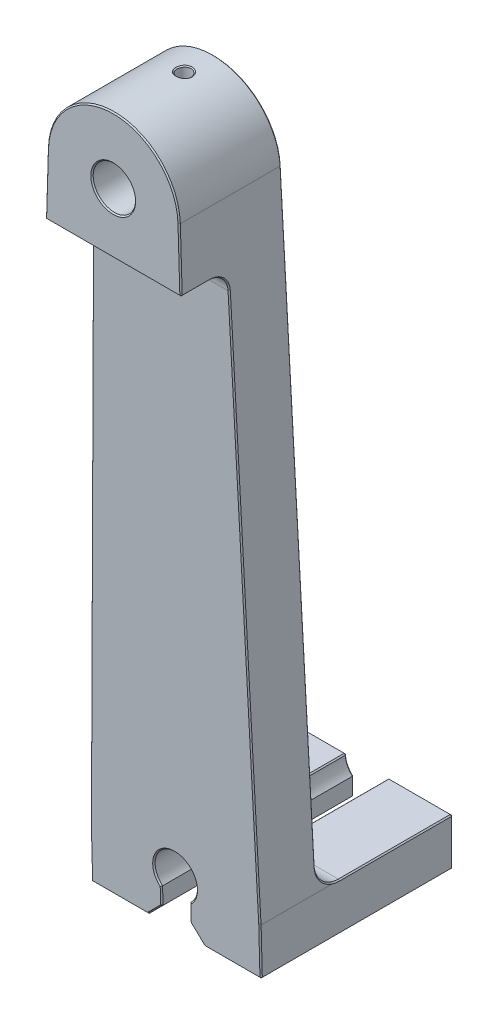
SolidWorks part; units mm, degrees
ref_plane "Спереди" through (0, 0, 0) normal (0, 0, 1) x (1, 0, 0)
ref_plane "Сверху" through (0, 0, 0) normal (0, 1, 0) x (1, 0, 0)
ref_plane "Справа" through (0, 0, 0) normal (1, 0, 0) x (0, 0, -1)
sketch "Эскиз1" plane through (0, 0, 0) normal (0, 0, 1) x (1, 0, 0)
  line L0 (0, 0) -> (0, -133) construction
  line L1 (-13.9937, 0.4202) -> (-18, -133)
  line L2 (-18, -133) -> (-18, -143)
  line L3 (-18, -143) -> (-6, -143)
  line L4 (-6, -143) -> (-3, -140)
  line L5 (-3, -140) -> (-3, -136.3541)
  line L6 (0, 14) -> (-108.3616, 14) construction
  line L7 (3, -140) -> (3, -136.3541)
  line L8 (6, -143) -> (3, -140)
  line L9 (18, -143) -> (6, -143)
  line L10 (18, -133) -> (18, -143)
  line L11 (13.9937, 0.4202) -> (18, -133)
  circle A0 centre (0, 0) radius 4.5
  arc A1 (13.9937, 0.4202) -> (-13.9937, 0.4202) centre (0, 0) ccw
  arc A2 (3, -136.3541) -> (-3, -136.3541) centre (0, -133) ccw
  dimension "D1" = 9
  dimension "D2" = 28
  dimension "D7" = 9
  dimension "D3" = 36
  dimension "D4" = 6
  dimension "D5" = 45
  dimension "D6" = 3
  dimension "D8" = 133
  dimension "D9" = 157
extrude "Бобышка-Вытянуть1" add sketch "Эскиз1" along normal blind 54
sketch "Эскиз2" plane through (0, 0, 0) normal (1, 0, 0) x (0, 0, -1)
  line L0 (-54, -12.79) -> (-47.8972, -12.79)
  line L1 (-54, -133) -> (-54, 0.4202) construction
  line L2 (-43.8986, -16.6859) -> (-40.61, -143)
  line L3 (-54, -143) -> (0, -143) construction
  line L4 (0, 14) -> (-54, 14) construction
  line L5 (0, -133) -> (-23.9948, -133)
  line L6 (0, -133) -> (0, 0.4202) construction
  line L7 (-28.9931, -128.1301) -> (-32.7043, 14.4202)
  line L8 (-32.7043, 14.4202) -> (0, 14.4202)
  line L9 (0, 0.4202) -> (0, 14) construction
  line L10 (0, 14.4202) -> (0, -133)
  line L11 (-54, -12.79) -> (-54, -143)
  line L12 (-54, -143) -> (-40.61, -143)
  arc A0 (-23.9948, -133) -> (-28.9931, -128.1301) centre (-23.9948, -128) cw
  arc A1 (-47.8972, -12.79) -> (-43.8986, -16.6859) centre (-47.8972, -16.79) cw
  point P23 (-44, -12.79)
  dimension "D7" = 5
  dimension "D8" = 4
  dimension "D1" = 26.79
  dimension "D2" = 13.39
  dimension "D3" = 10
  dimension "D4" = 14
  dimension "D5" = 10
  dimension "D6" = 12
extrude "Вырез-Вытянуть1" cut sketch "Эскиз2" against normal mid plane 54
chamfer "Фаска1" distance 0.25 angle 45 45 edges at (4.5, 0, 54) (0, -4.5, 32.2118) (-17.9574, -131.5812, 27.484) (-15.9237, -63.855, 30.6665) (17.9574, -131.5812, 27.484) (0, 14, 32.6934) (15.9237, -63.855, 30.6665) (-14.3904, -12.79, 50.9486) (-14.4244, -13.925, 45.1058) (-16.2537, -74.8429, 42.3845) (-4.5, -133, 11.9974) (4.5, -133, 11.9974) (-0.2372, -128.5063, 19.0205) (3, -138.1771, 0) (4.5, -141.5, 0) (12, -143, 0) (4.1079, -134.8371, 0) (11.25, -133, 0) (18, -133, 11.9974) (18, -138, 0) (18, -143, 20.305) (18, -138, 40.7402) (-12, -143, 0) (-4.5, -141.5, 0) (-3, -138.1771, 0) (-4.1079, -134.8371, 0) (-11.25, -133, 0) (-18, -133, 11.9974) (-18, -138, 0) (-18, -143, 20.305) (-18, -138, 40.7402) (-12, -143, 40.61) (-4.5, -141.5, 40.6491) (-3, -138.1771, 40.7356) (0, -128.5, 40.9875) (3, -138.1771, 40.7356) (4.5, -141.5, 40.6491) (12, -143, 40.61) (14.3904, -12.79, 50.9486) (16.2537, -74.8429, 42.3845) (14.4244, -13.925, 45.1058) (14.192, -6.1849, 54) (0, 14, 54) (-14.192, -6.1849, 54) (0, -12.79, 54)
sketch "Эскиз3" plane through (0, 0, 0) normal (0, 1, 0) x (1, 0, 0)
  circle A0 centre (0, -39) radius 1.5
  dimension "D1" = 3
  dimension "D2" = 39
extrude "Вырез-Вытянуть2" cut sketch "Эскиз3" along normal through all
chamfer "Фаска2" distance 0.25 angle 45 2 edges at (0.3353, 13.996, 40.462) (0.2549, 4.4928, 40.4782)
